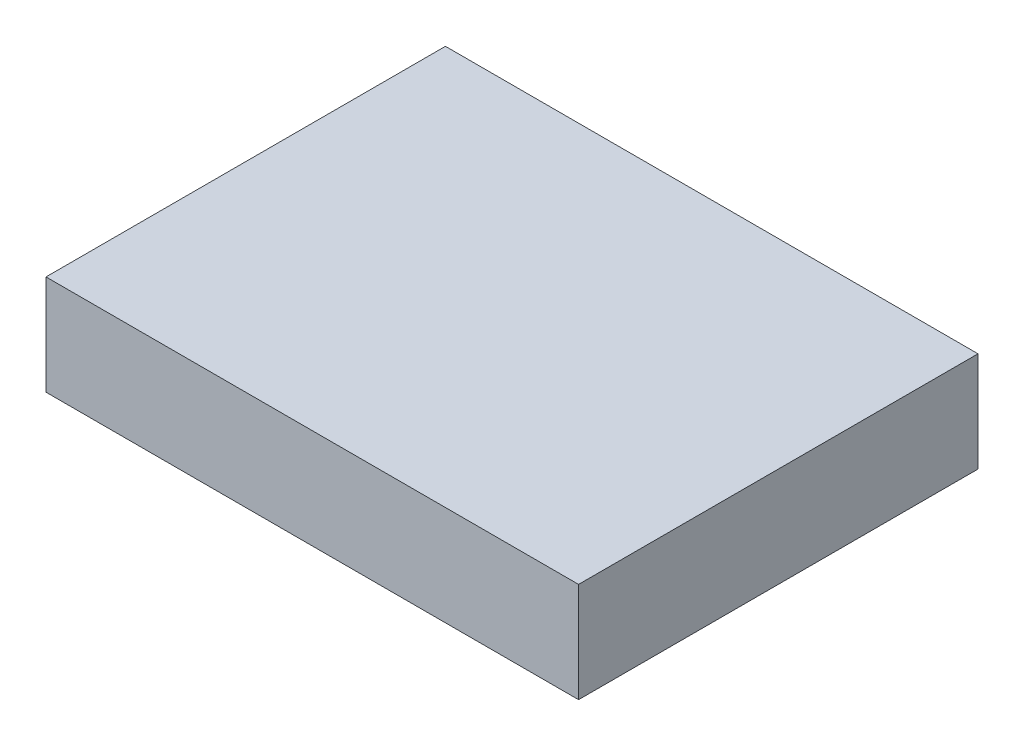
SolidWorks part; units mm, degrees
ref_plane "前视基准面" through (0, 0, 0) normal (0, 0, 1) x (1, 0, 0)
ref_plane "上视基准面" through (0, 0, 0) normal (0, 1, 0) x (1, 0, 0)
ref_plane "右视基准面" through (0, 0, 0) normal (1, 0, 0) x (0, 0, -1)
other "Configuration Table"
sketch "BaseSketch" plane through (0, 0, 0) normal (0, 1, 0) x (1, 0, 0)
  line L1 (0, 0) -> (80, 0)
  line L2 (0, 0) -> (0, 60)
  line L3 (0, 60) -> (80, 60)
  line L4 (80, 0) -> (80, 60)
  dimension "D1" = 80
  dimension "D2" = 60
extrude "BaseBoss" add sketch "BaseSketch" against normal blind 15
